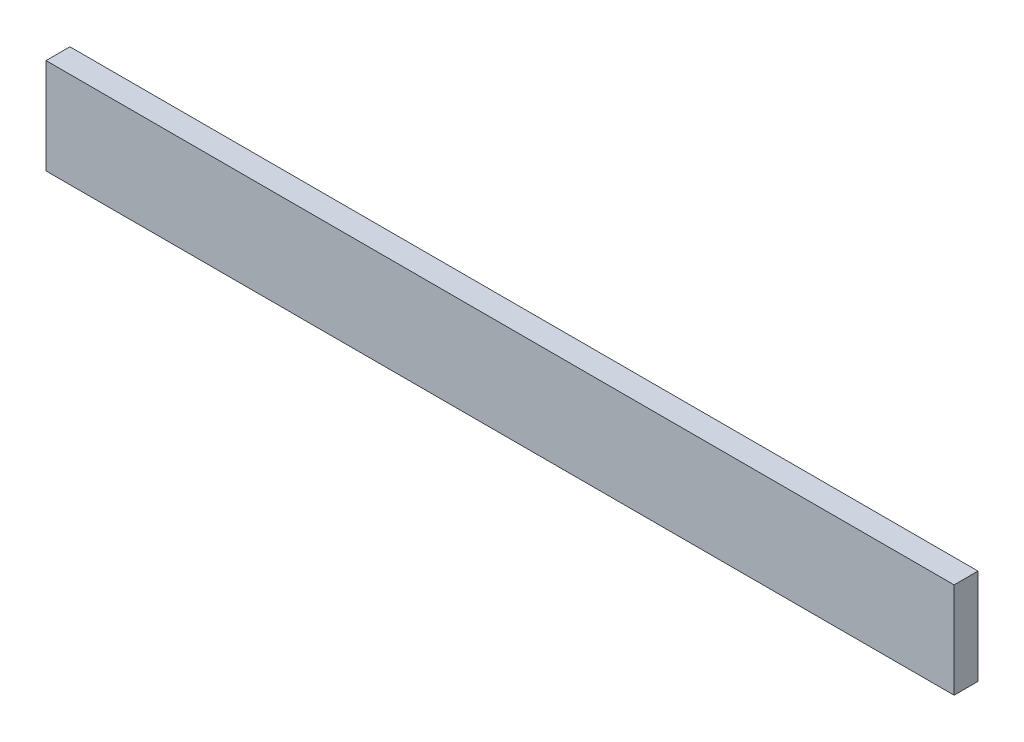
SolidWorks part; units mm, degrees
ref_plane "Front Plane" through (0, 0, 0) normal (0, 0, 1) x (1, 0, 0)
ref_plane "Top Plane" through (0, 0, 0) normal (0, 1, 0) x (1, 0, 0)
ref_plane "Right Plane" through (0, 0, 0) normal (1, 0, 0) x (0, 0, -1)
sketch "Sketch1" plane through (0, 0, 0) normal (0, 0, 1) x (1, 0, 0)
  line L1 (-237.5, -25) -> (237.5, -25)
  line L2 (-237.5, -25) -> (-237.5, 25)
  line L3 (-237.5, 25) -> (237.5, 25)
  line L4 (237.5, -25) -> (237.5, 25)
  line L5 (-237.5, -25) -> (237.5, 25) construction
  line L6 (-237.5, 25) -> (237.5, -25) construction
  point P0 (0, 0)
  dimension "D1" = 50
  dimension "D2" = 475
extrude "Boss-Extrude1" add sketch "Sketch1" along normal blind 12.5
